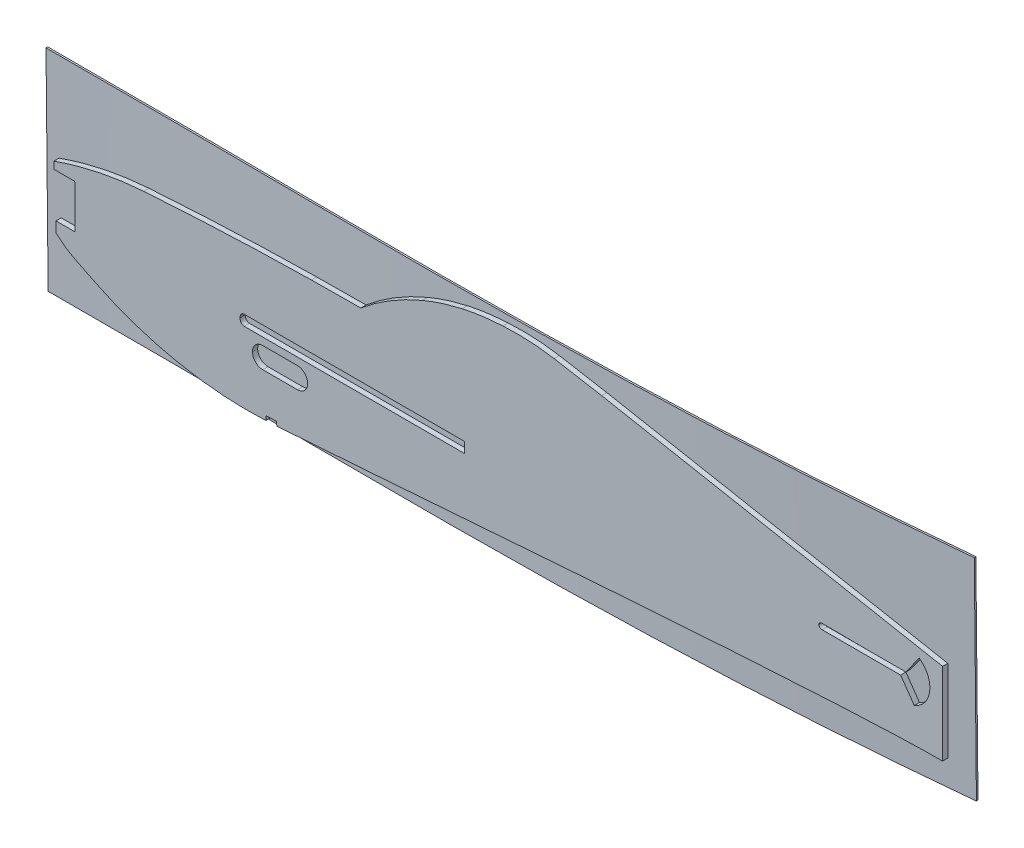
SolidWorks part; units mm, degrees
ref_plane "Спереди" through (0, 0, 0) normal (0, 0, 1) x (1, 0, 0)
ref_plane "Сверху" through (0, 0, 0) normal (0, 1, 0) x (1, 0, 0)
ref_plane "Справа" through (0, 0, 0) normal (1, 0, 0) x (0, 0, -1)
sketch "Эскиз1" plane through (0, 0, 0) normal (0, 0, 1) x (1, 0, 0)
  line L0 (-105.606, -16.6194) -> (-145.597, -16.6194)
  line L1 (-254.6182, 10.7702) -> (-254.6182, 6.7702)
  line L2 (-253.3818, -18.2298) -> (-253.3818, -24.2298)
  line L3 (59.2727, 51.3692) -> (254.6182, 14.7185)
  line L4 (230.6297, -1.6194) -> (185.6297, -1.6194)
  line L5 (-145.597, -10.6194) -> (-19.4186, -10.6194)
  line L6 (-134.8863, -32.8406) -> (-115.0429, -32.8406)
  line L7 (-115.0429, -20.8406) -> (-134.8863, -20.8406)
  line L8 (-242.3818, -18.2182) -> (-253.3818, -18.2298)
  line L9 (-242.6182, 6.7807) -> (-254.6182, 6.7702)
  line L10 (-242.3818, -18.2182) -> (-242.6182, 6.7807)
  line L11 (-126.7945, -56.8182) -> (-127.1404, -54.4342)
  line L12 (-133.1404, -57.1875) -> (-133.1404, -54.8036)
  line L13 (-133.1404, -54.8036) -> (-127.1404, -54.4342)
  line L14 (59.2727, 51.3692) -> (32.0197, 56.1648)
  line L15 (-19.4186, -10.6194) -> (-19.4186, -16.6194)
  line L16 (-105.606, -16.6194) -> (-19.4186, -16.6194)
  line L17 (185.5626, 1.5704) -> (208.579, 1.3806)
  line L18 (254.6182, -32.2815) -> (254.6182, 14.7185)
  line L19 (230.6297, -1.6194) -> (238.4343, -12.8084)
  line L20 (233.5622, 1.3806) -> (241.2548, 12.1385)
  line L21 (208.579, 1.3806) -> (233.5622, 1.3806)
  spline S0 degree 3 poles (254.6182, -32.2815) (179.1633, -32.2815) (-68.3662, -53.187) (-126.7945, -56.8182) knots 0 0 0 0 0.620924 0.620924 0.620924 0.620924
  spline S1 degree 3 poles (-133.1404, -57.1875) (-167.0426, -58.8356) (-201.1429, -52.2592) (-231.8873, -37.0419) knots 0.643258 0.643258 0.643258 0.643258 1 1 1 1
  spline S2 degree 2 poles (-203.0791, 21.5817) (-155.0664, 24.8558) (-106.9511, 25.6387) knots 0 0 0 1 1 1
  spline S3 degree 3 poles (-253.3818, -24.2298) (-245.4886, -31.0693) (-244.3483, -30.626) (-231.8873, -37.0419) knots 0 0 0 0 1 1 1 1
  spline S4 degree 3 poles (-140.7886, -26.8573) (-140.8108, -30.114) (-138.1767, -32.8181) (-134.8863, -32.8406) knots 0 0 0 0 0.333333 0.333333 0.333333 0.333333
  spline S5 degree 3 poles (-115.0429, -32.8406) (-111.7862, -32.8184) (-109.1185, -30.114) (-109.1407, -26.8573) knots 0.666667 0.666667 0.666667 0.666667 1 1 1 1
  spline S6 degree 3 poles (-109.1407, -26.8573) (-109.1184, -23.5669) (-111.7862, -20.8627) (-115.0429, -20.8406) knots 0 0 0 0 0.25 0.25 0.25 0.25
  spline S7 degree 3 poles (-134.8863, -20.8406) (-138.1767, -20.8629) (-140.8109, -23.5669) (-140.7886, -26.8573) knots 0.5 0.5 0.5 0.5 0.75 0.75 0.75 0.75
  spline S8 degree 3 poles (-145.597, -10.6194) (-146.9063, -10.6378) (-147.9619, -11.9899) (-147.939, -13.6194) knots 0 0 0 0 0.333333 0.333333 0.333333 0.333333
  spline S9 degree 3 poles (-147.939, -13.6194) (-147.9619, -15.2489) (-146.9063, -16.601) (-145.597, -16.6194) knots 0.333333 0.333333 0.333333 0.333333 0.666667 0.666667 0.666667 0.666667
  spline S10 degree 3 poles (-254.6182, 10.7702) (-238.0317, 16.7131) (-220.6729, 20.4065) (-203.0791, 21.5817) knots 0 0 0 0 1 1 1 1
  spline S11 degree 3 poles (-78.7138, 25.8793) (-68.1037, 34.7434) (-56.1507, 41.9958) (-43.3918, 47.3008) knots 0 0 0 0 0.25 0.25 0.25 0.25
  spline S12 degree 3 poles (-43.3918, 47.3008) (-36.0052, 50.3898) (-28.3834, 52.8073) (-20.5938, 54.5532) knots 0.25 0.25 0.25 0.25 0.5 0.5 0.5 0.5
  spline S13 degree 3 poles (-20.5938, 54.5532) (-12.9385, 56.2321) (-5.1153, 57.2728) (2.7414, 57.6758) knots 0.5 0.5 0.5 0.5 0.75 0.75 0.75 0.75
  spline S14 degree 3 poles (2.7414, 57.6758) (12.5121, 58.2129) (22.3499, 57.8101) (32.0197, 56.1648) knots 0.75 0.75 0.75 0.75 1 1 1 1
  spline S15 degree 3 poles (-106.9511, 25.6387) (-97.5379, 25.7912) (-88.1251, 25.8717) (-78.7138, 25.8793) knots 0 0 0 0 1 1 1 1
  spline S16 degree 3 poles (185.5626, 1.5704) (184.4882, 1.5368) (183.6488, 0.7981) (183.6823, -0.0749) knots 0 0 0 0 0.5 0.5 0.5 0.5
  spline S17 degree 3 poles (183.6823, -0.0749) (183.7158, -0.9143) (184.5889, -1.5857) (185.6297, -1.6194) knots 0.5 0.5 0.5 0.5 1 1 1 1
  spline S18 degree 3 poles (238.4343, -12.8084) (243.8401, -10.626) (247.3656, -5.3882) (247.3656, 0.4541) knots 0 0 0 0 1 1 1 1
  spline S19 degree 3 poles (247.3656, 0.4541) (247.3656, 5.0876) (245.0825, 9.4524) (241.2548, 12.1385) knots 0 0 0 0 1 1 1 1
  dimension "D1" = 47
  dimension "D2" = 45
  dimension "D3" = 48
  dimension "D4" = 3
  dimension "D5" = 5
  dimension "D6" = 508
extrude "Бобышка-Вытянуть1" add sketch "Эскиз1" along normal blind 3
ref_plane "Плоскость1" through (0, 60, 0) normal (0, 1, 0) x (1, 0, 0)
ref_plane "Плоскость2" through (0, -60, 0) normal (0, 1, 0) x (1, 0, 0)
sketch "Эскиз2" plane through (0, 60, 0) normal (0, 1, 0) x (1, 0, 0)
  spline S0 degree 3 poles (-263.8549, 2.7616) (-98.576, 3.6785) (62.6707, -3.6135) (254.9814, 15.7313) knots 0 0 0 0 1 1 1 1
sketch "Эскиз5" plane through (0, -60, 0) normal (0, 1, 0) x (1, 0, 0)
  spline S0 degree 3 poles (-262.4289, 2.5651) (-97.15, 3.482) (64.0967, -3.81) (256.4074, 15.5347) knots 0 0 0 0 1 1 1 1
sheet metal parameters "Листовой металл1" thickness 1 parameters "D1"=0.7366
lofted bend "Элемент по сечениям сгиба 1" thickness 1 parameters "D1"=0
other "Свободный изгиб1" parameters "D1"=1000, "D4"=57.296, "D5"=1
flat pattern "Развертка1"
sketch "Сгиб-Линии1" plane through (0, 0, 0) normal (0, 1, 0) x (1, 0, 0)
sketch "Граничная рамка1" [suppressed] plane through (0, 0, 0) normal (0, 1, 0) x (1, 0, 0)
other "Плоское состояние-<Свободный изгиб1>1"
